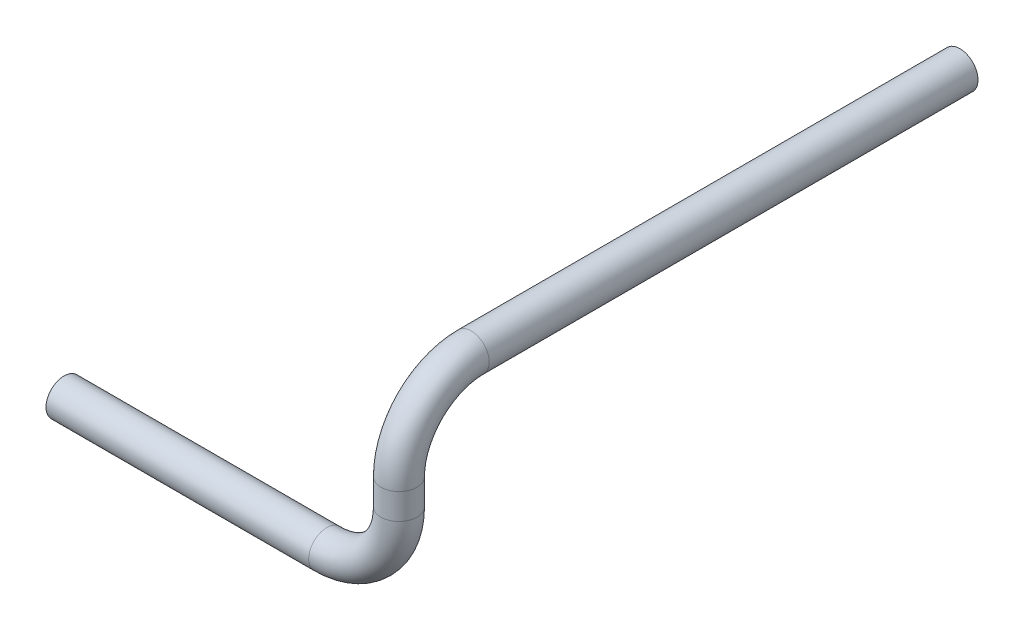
SolidWorks part; units mm, degrees
ref_plane "Plan de face" through (0, 0, 0) normal (0, 0, 1) x (1, 0, 0)
ref_plane "Plan de dessus" through (0, 0, 0) normal (0, 1, 0) x (1, 0, 0)
ref_plane "Plan de droite" through (0, 0, 0) normal (1, 0, 0) x (0, 0, -1)
sketch "Esquisse1" plane through (0, 0, 0) normal (0, 0, 1) x (1, 0, 0)
  circle A0 centre (6.25, -6.25) radius 0.25
  dimension "D1" = 0.5
ref_plane "Plan1" through (0, -6.25, 0) normal (0, 1, 0) x (-1, 0, 0)
sketch3d "Esquisse3D1"
  line L0 (6.25, -6.25, 0) -> (6.25, -6.25, 6.768)
  line L1 (6.25, -7.25, 7.768) -> (6.25, -7.6088, 7.768)
  line L2 (5.25, -8.6088, 7.768) -> (1.6128, -8.6088, 7.768)
  line L3 (1.6128, -8.3, 7.768) -> (1.6128, -10.6, 7.768) construction
  arc A0 (6.25, -7.25, 7.768) -> (6.25, -6.25, 6.768) centre (6.25, -7.25, 6.768) ccw
  arc A1 (6.25, -7.6088, 7.768) -> (5.25, -8.6088, 7.768) centre (5.25, -7.6088, 7.768) ccw
  point P9 (6.25, -6.25, 7.768)
  point P10 (5.25, -7.25, 6.768)
  point P13 (6.25, -8.6088, 7.768)
  point P14 (5.25, -7.6088, 6.768)
  dimension "D1" = 1
  dimension "D2" = 1
sweep "Balayage1" add profiles "Esquisse1" path "Esquisse3D1"
